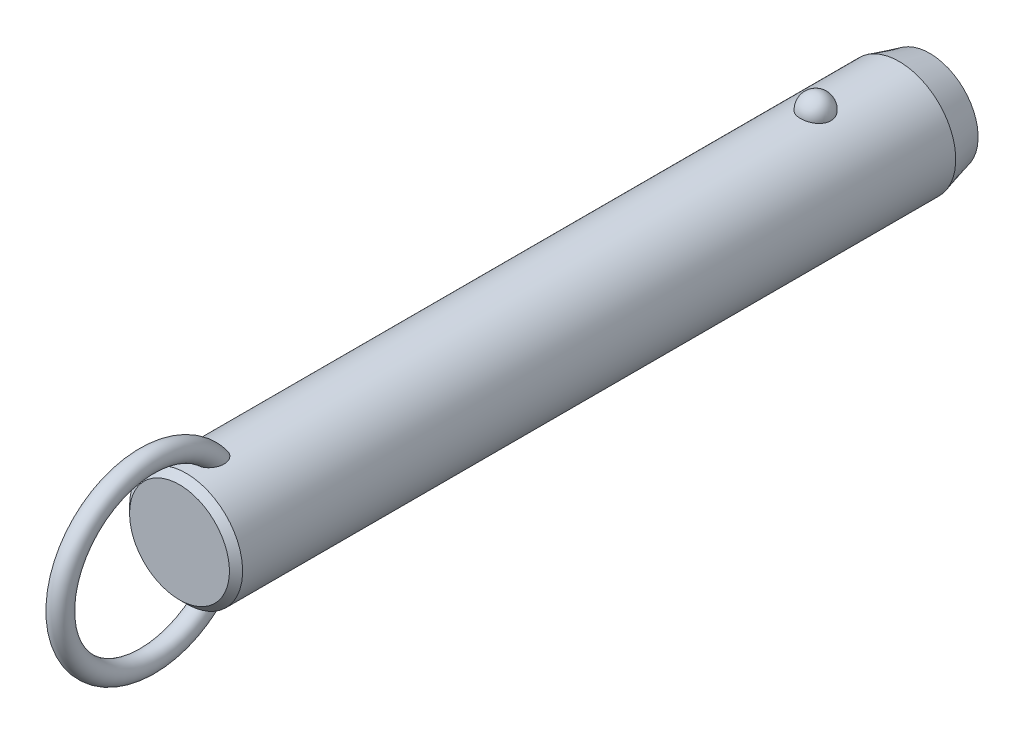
SolidWorks part; units mm, degrees
ref_plane "Front Plane" through (0, 0, 0) normal (0, 0, 1) x (1, 0, 0)
ref_plane "Top Plane" through (0, 0, 0) normal (0, 1, 0) x (1, 0, 0)
ref_plane "Right Plane" through (0, 0, 0) normal (1, 0, 0) x (0, 0, -1)
sketch "Sketch2" plane through (0, 0, 0) normal (0, 0, 1) x (1, 0, 0)
  circle A0 centre (0, 0) radius 11.1
  point P3 (0, 11.1)
  dimension "D1" = 22.2
extrude "Boss-Extrude1" add sketch "Sketch2" along normal blind 109.2
sketch "Sketch3" plane through (0, 0, 0) normal (0, 0, -1) x (-1, 0, 0)
  circle A0 centre (0, 0) radius 11.1
  dimension "D1" = 22.2
extrude "Boss-Extrude2" add sketch "Sketch3" along normal blind 25.4
chamfer "Chamfer1" distance 6 angle 15 1 edges at (-11.1, 0, -25.4)
sketch "Sketch12" plane through (0, 0, 0) normal (1, 0, 0) x (0, 0, -1)
  line L0 (-109.2, 11.1) -> (-109.2, -11.1) construction
  point P0 (-109.2, 0)
sketch "Sketch13" plane through (0, 0, 0) normal (1, 0, 0) x (0, 0, -1)
  circle A0 centre (-128.25, 0) radius 19.05
  point P2 (-109.2, 0)
  dimension "D1" = 38.1
sketch "Sketch14" plane through (0, 0, 0) normal (0, 1, 0) x (1, 0, 0)
  circle A0 centre (0, -111.2) radius 2
  point P2 (0, -109.2)
  dimension "D1" = 4
sweep "Sweep1" add profiles "Sketch14" path "Sketch13"
sketch "Sketch15" plane through (0, 0, 109.2) normal (0, 0, 1) x (1, 0, 0)
  circle A0 centre (0, 0) radius 11.1
  dimension "D1" = 22.2
extrude "Boss-Extrude3" add sketch "Sketch15" along normal blind 12.7
chamfer "Chamfer2" distance 1.3 angle 45 1 edges at (11.1, 0, 121.9)
sketch "Sketch18" plane through (0, 0, 0) normal (1, 0, 0) x (0, 0, -1)
  line L0 (19.4, 11.1) -> (-112.768, 11.1) construction
  line L1 (3, 14.1) -> (3, 8.1)
  line L2 (-112.768, -11.1) -> (19.4, -11.1) construction
  arc A0 (3, 14.1) -> (3, 8.1) centre (3, 11.1) ccw
  point P4 (0, 11.1)
  dimension "D1" = 25.2
revolve "Revolve1" add sketch "Sketch18" angle 360 about L1
